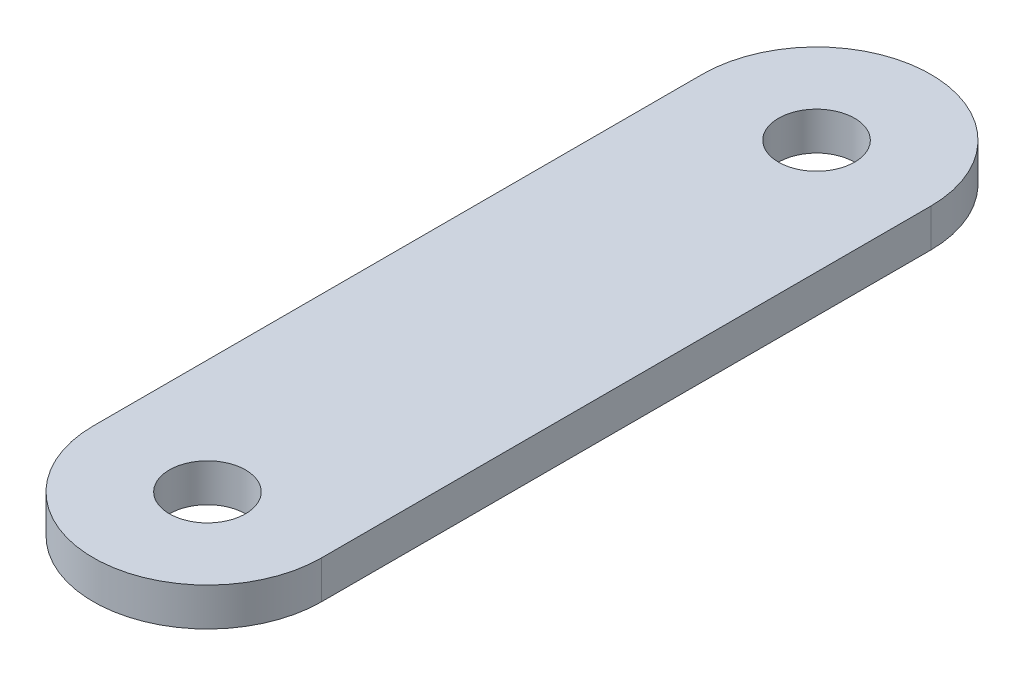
SolidWorks part; units mm, degrees
ref_plane "Front" through (0, 0, 0) normal (0, 0, 1) x (1, 0, 0)
ref_plane "Top" through (0, 0, 0) normal (0, 1, 0) x (1, 0, 0)
ref_plane "Right" through (0, 0, 0) normal (1, 0, 0) x (0, 0, -1)
sketch "Sketch1" plane through (0, 0, 0) normal (0, 1, 0) x (1, 0, 0)
  line L0 (0, 9) -> (-7.5377, 9) construction
  line L1 (-3, 8) -> (3, 8) construction
  line L2 (-3, 8) -> (-3, 0)
  line L3 (-3, 0) -> (3, 0)
  line L4 (3, 8) -> (3, 0)
  line L5 (0, 11) -> (-7.5377, 11) construction
  circle A0 centre (0, 8) radius 1
  arc A1 (-3, 8) -> (3, 8) centre (0, 8) cw
  point P4 (0, 0)
  dimension "D1" = 2
  dimension "D2" = 2
  dimension "D3" = 8
extrude "Boss-Extrude1" add sketch "Sketch1" along normal blind 1
mirror "Mirror1" about plane through (-3, 1, 0) normal (0, 0, -1)
